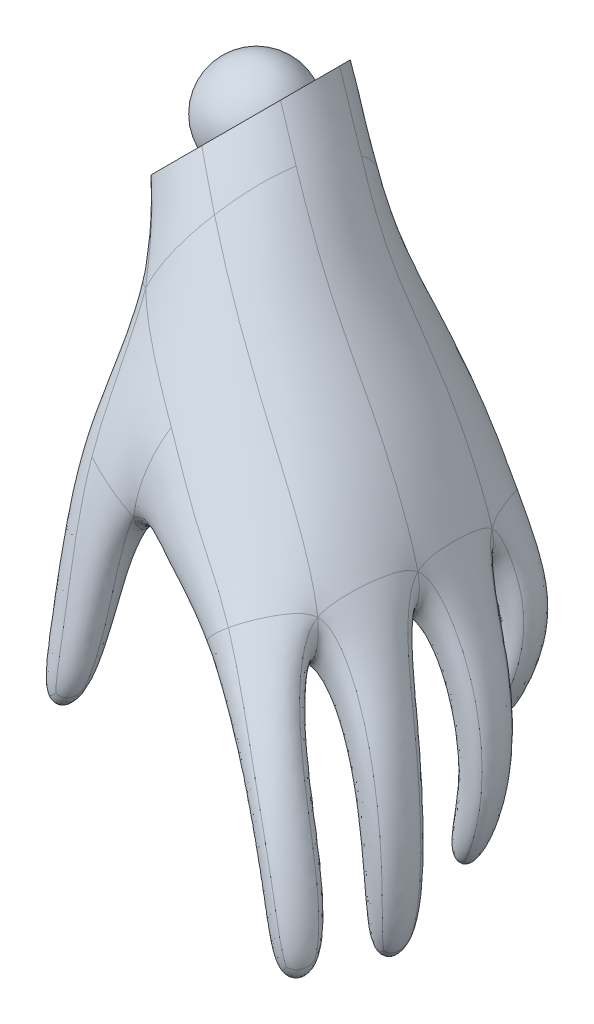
SolidWorks part; units mm, degrees
ref_plane "Front Plane" through (0, 0, 0) normal (0, 0, 1) x (1, 0, 0)
ref_plane "Top Plane" through (0, 0, 0) normal (0, 1, 0) x (1, 0, 0)
ref_plane "Right Plane" through (0, 0, 0) normal (1, 0, 0) x (0, 0, -1)
imported_body "Stock-Source-1"
ref_plane "Plane1" through (0, 0, 142.24) normal (0, 0, 1) x (1, 0, 0)
sketch "Sketch1" plane through (0, 0, 142.24) normal (0, 0, 1) x (1, 0, 0)
  line L0 (545.196, 3833.9509) -> (568.9172, 3857.672)
  line L1 (565.0439, 3853.7987) -> (550.0836, 3838.8384) construction
  line L2 (572.7905, 3861.5453) -> (565.0439, 3853.7987) construction
  line L3 (550.0836, 3838.8384) -> (540.3085, 3829.0634) construction
  arc A0 (545.196, 3833.9509) -> (568.9172, 3857.672) centre (557.0566, 3845.8114) cw
revolve "Revolve1" add sketch "Sketch1" angle 360 about L0
